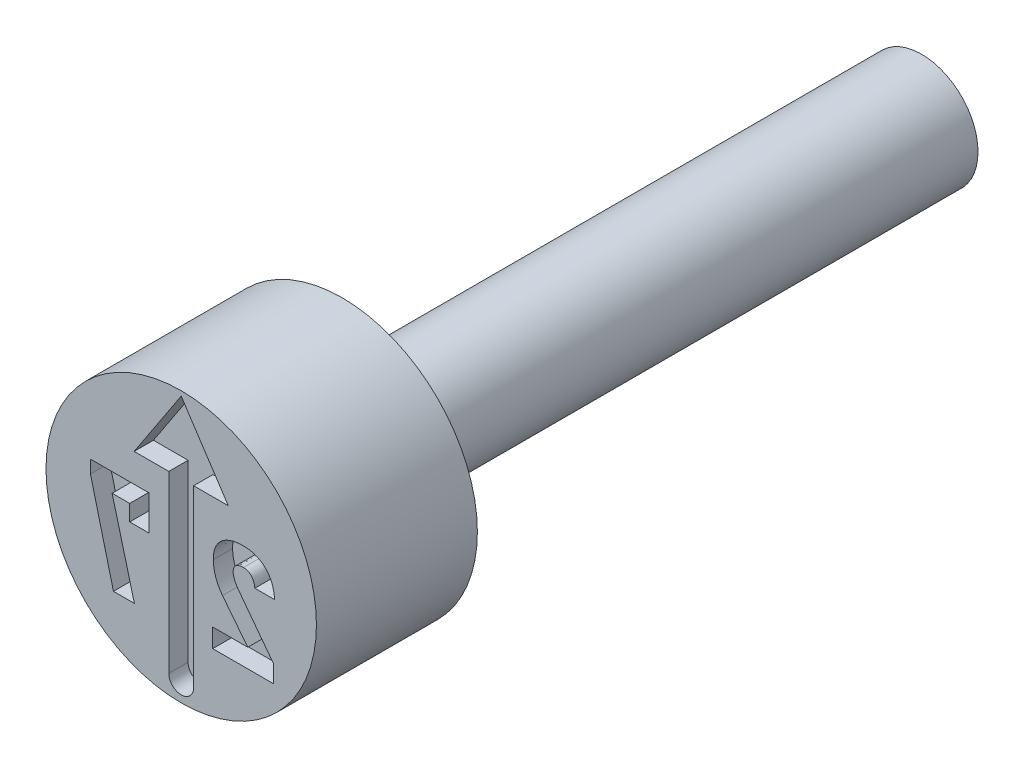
SolidWorks part; units mm, degrees
ref_plane "Front Plane" through (0, 0, 0) normal (0, 0, 1) x (1, 0, 0)
ref_plane "Top Plane" through (0, 0, 0) normal (0, 1, 0) x (1, 0, 0)
ref_plane "Right Plane" through (0, 0, 0) normal (1, 0, 0) x (0, 0, -1)
sketch "Sketch2" plane through (0, 0, 0) normal (1, 0, 0) x (0, 0, -1)
  line L0 (0.4039, 0) -> (50000.4039, 0) construction
  line L6 (0, 4.2) -> (0, 0)
  line L7 (5, 4.2) -> (0, 4.2)
  line L8 (5, 1.75) -> (5, 4.2)
  line L9 (23, 1.75) -> (5, 1.75)
  line L10 (23, 0) -> (23, 1.75)
  line L11 (0, 0) -> (23, 0)
  dimension "D1" = 8.4
  dimension "D2" = 3.5
  dimension "D3" = 23
  dimension "D4" = 5
revolve "Revolve1" add sketch "Sketch2" angle 360 about L0
sketch "Sketch3" plane through (0, 0, 0) normal (0, 0, 1) x (1, 0, 0)
  line L0 (0, 0) -> (0, 202500) construction
  line L1 (0.3857, 1.8354) -> (0.3857, -3.5967)
  line L2 (1.4619, 1.8354) -> (0.3857, 1.8354)
  line L3 (0, 4.0543) -> (1.4619, 1.8354)
  line L15 (0, 4.0543) -> (-1.4619, 1.8354)
  line L16 (-1.4619, 1.8354) -> (-0.3857, 1.8354)
  line L17 (-0.3857, 1.8354) -> (-0.3857, -3.5967)
  arc A2 (-0.3857, -3.5967) -> (0.3857, -3.5967) centre (0, -3.5967) ccw
extrude "Cut-Extrude4" cut sketch "Sketch3" against normal blind 0.6
sketch "Sketch4" plane through (0, 0, 0) normal (0, 0, 1) x (1, 0, 0)
  text T0 "2  7" font "Bahnschrift" height 3.2
  dimension "D1" = 2.25
  dimension "D2" = 3.1
extrude "Cut-Extrude5" cut sketch "Sketch4" against normal blind 0.6
